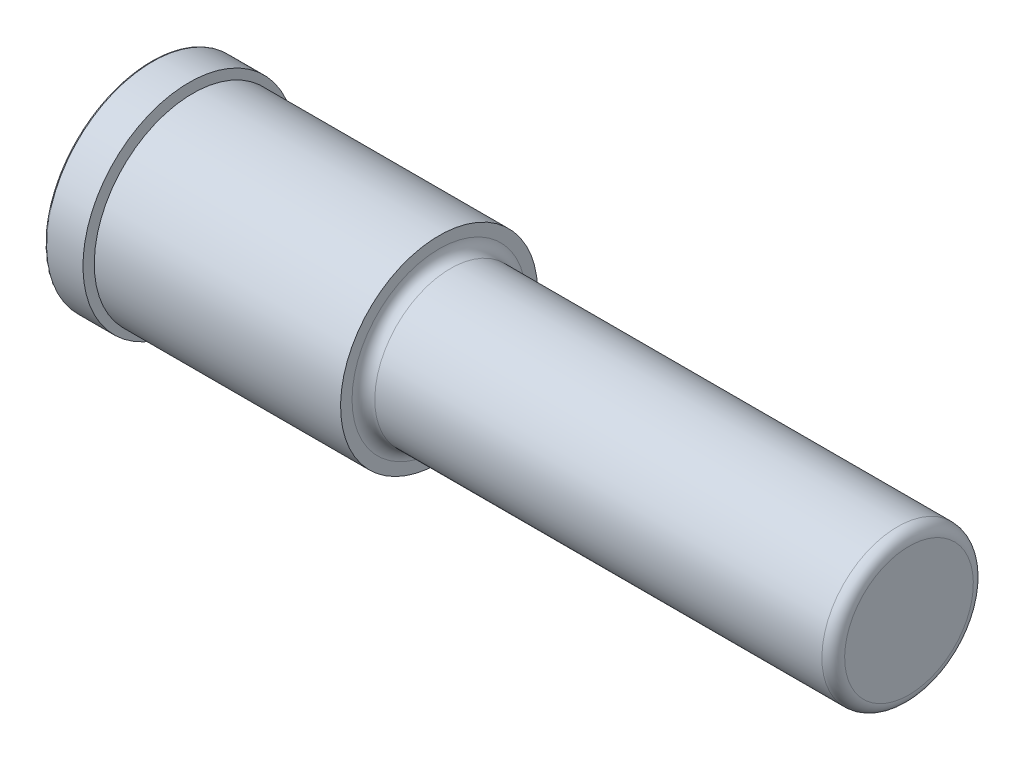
SolidWorks part; units mm, degrees
ref_plane "Front Plane" through (0, 0, 0) normal (0, 0, 1) x (1, 0, 0)
ref_plane "Top Plane" through (0, 0, 0) normal (0, 1, 0) x (1, 0, 0)
ref_plane "Right Plane" through (0, 0, 0) normal (1, 0, 0) x (0, 0, -1)
sketch "Sketch1" plane through (0, 0, 0) normal (0, 0, 1) x (1, 0, 0)
  line L0 (158.75, 0) -> (0, 0) construction
  line L1 (0, 0) -> (0, 21.9075)
  line L2 (0.3175, 22.225) -> (7.9375, 22.225)
  line L3 (7.9375, 22.225) -> (7.9375, 19.5062)
  line L4 (7.9375, 19.5062) -> (8.7312, 19.5062)
  line L5 (8.7312, 19.5062) -> (8.7312, 20.6502)
  line L6 (8.7312, 20.6502) -> (60.325, 20.6502)
  line L7 (60.325, 20.6502) -> (60.325, 18.2435)
  line L8 (62.7063, 15.8623) -> (156.3688, 15.8623)
  line L9 (158.75, 13.4811) -> (158.75, 0)
  line L10 (158.75, 0) -> (0, 0)
  line L11 (0, 0) -> (-16.568, 0) construction
  line L12 (158.75, 0) -> (53.1955, 0) construction
  arc A0 (0, 21.9075) -> (0.3175, 22.225) centre (0.3175, 21.9075) cw
  arc A1 (60.325, 18.2435) -> (62.7063, 15.8623) centre (62.7063, 18.2435) ccw
  arc A2 (156.3688, 15.8623) -> (158.75, 13.4811) centre (156.3688, 13.4811) cw
  dimension "D3" = 0.3175
  dimension "D4" = 2.3813
  dimension "D5" = 2.3812
  dimension "D1" = 0.7937
  dimension "HeadDia" = 44.45
  dimension "PF" = 41.3004
  dimension "PinDia" = 31.7246
  dimension "D2" = 1.144
  dimension "PFL" = 60.325
  dimension "OverallLength" = 158.75
revolve "Revolve1" add sketch "Sketch1" angle 360 about L0
